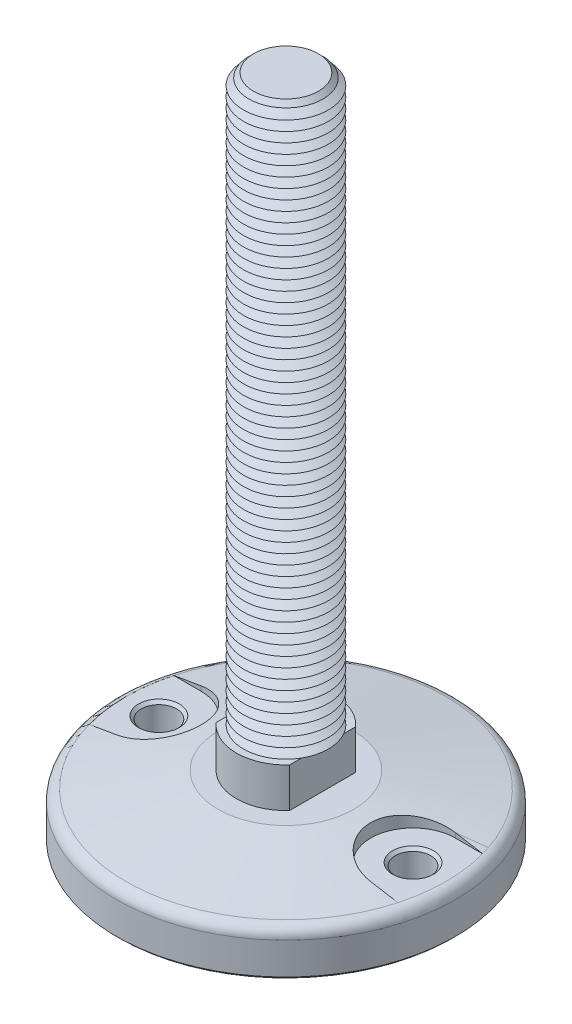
SolidWorks part; units mm, degrees
ref_plane "Front Plane" through (0, 0, 0) normal (0, 0, 1) x (1, 0, 0)
ref_plane "Top Plane" through (0, 0, 0) normal (0, 1, 0) x (1, 0, 0)
ref_plane "Right Plane" through (0, 0, 0) normal (1, 0, 0) x (0, 0, -1)
sketch "Sketch1" plane through (0, 0, 0) normal (1, 0, 0) x (0, 0, -1)
  line L0 (0, 61.3389) -> (0, -58.404) construction
sketch "Sketch2" plane through (0, 0, 0) normal (1, 0, 0) x (0, 0, -1)
  line L0 (0, 0) -> (-24, 0)
  line L1 (-24, 0) -> (-60, -6.3478)
  line L2 (-60, -6.3478) -> (-60, -22)
  line L3 (-60, -22) -> (0, -22)
  line L4 (0, 61.3389) -> (0, -58.404) construction
  line L5 (0, -22) -> (0, 0)
  dimension "D1" = 22
  dimension "D2" = 60
  dimension "D3" = 24
  dimension "D4" = 10
revolve "Revolve1" add sketch "Sketch2" angle 360 about L0
fillet "Fillet1" radius 4 1 edges at (0, -6.3478, 60)
sketch "Sketch3" plane through (0, 0, 0) normal (0, 1, 0) x (1, 0, 0)
  circle A0 centre (0, 0) radius 17.5
  dimension "D1" = 35
extrude "Boss-Extrude1" add sketch "Sketch3" along normal blind 14
sketch "Sketch4" plane through (0, 14, 0) normal (0, 1, 0) x (1, 0, 0)
  line L0 (-13, 11.7154) -> (-13, -11.7154)
  line L2 (13, -11.7154) -> (13, 11.7154)
  arc A0 (-13, 11.7154) -> (-13, -11.7154) centre (0, 0) ccw
  circle A1 centre (0, 0) radius 17.5 construction
  arc A2 (13, -11.7154) -> (13, 11.7154) centre (0, 0) ccw
  dimension "D1" = 26
extrude "Cut-Extrude1" cut sketch "Sketch4" against normal blind 14
sketch "Sketch5" plane through (0, 14, 0) normal (0, 1, 0) x (1, 0, 0)
  circle A0 centre (0, 0) radius 15
  dimension "D1" = 30
extrude "Boss-Extrude2" add sketch "Sketch5" along normal blind 200
chamfer "Chamfer1" distance 3.5 angle 45 1 edges at (0, 214, 15)
sketch "Sketch6" plane through (0, 0, 0) normal (1, 0, 0) x (0, 0, -1)
  line L0 (-15, 14) -> (-11.9689, 15.75)
  line L1 (-11.9689, 15.75) -> (-15, 17.5)
  line L2 (-15, 210.5) -> (-15, 14) construction
  line L3 (-15, 17.5) -> (-15, 14)
  dimension "D1" = 3.5
revolve "Cut-Revolve1" cut sketch "Sketch6" angle 360 about L0
pattern_linear "LPattern1" count 57 spacing 3.5 along (0, 1, 0) of "Cut-Revolve1"
sketch "Sketch8" plane through (0, 0, 0) normal (0, 1, 0) x (1, 0, 0)
  line L0 (-45, 15) -> (-54.6743, 15)
  line L1 (-45, -15) -> (-54.6743, -15)
  arc A1 (-54.6743, 15) -> (-54.6743, -15) centre (0, 0) ccw
  circle A2 centre (0, 0) radius 56.6946 construction
  arc A3 (-45, -15) -> (-45, 15) centre (-45, 0) ccw
  point P3 (-45, 0)
  point P11 (0, 0)
  dimension "D1" = 45
  dimension "D2" = 30
extrude "Cut-Extrude4" cut sketch "Sketch8" against normal blind 5.79
sketch "Sketch10" plane through (0, -5.79, 0) normal (0, 1, 0) x (1, 0, 0)
  circle A0 centre (-45, 0) radius 6.25
  dimension "D1" = 12.5
extrude "Cut-Extrude5" cut sketch "Sketch10" against normal up to surface (16.21 mm away)
chamfer "Chamfer2" distance 1 angle 45 2 edges at (-45, -22, -6.25) (-45, -5.79, 6.25)
mirror "Mirror1" about plane through (0, 0, 0) normal (1, 0, 0) of "Chamfer2", "Cut-Extrude5", "Cut-Extrude4"
chamfer "Chamfer3" distance 1 angle 45 1 edges at (0, -22, 60)
